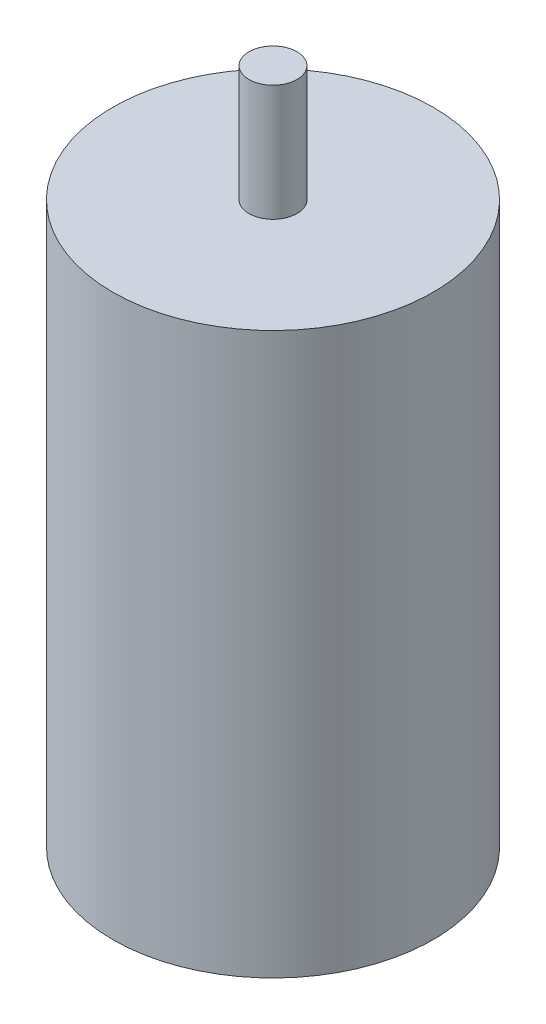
SolidWorks part; units mm, degrees
ref_plane "Front Plane" through (0, 0, 0) normal (0, 0, 1) x (1, 0, 0)
ref_plane "Top Plane" through (0, 0, 0) normal (0, 1, 0) x (1, 0, 0)
ref_plane "Right Plane" through (0, 0, 0) normal (1, 0, 0) x (0, 0, -1)
sketch "Sketch1" plane through (0, 0, 0) normal (0, 1, 0) x (1, 0, 0)
  circle A0 centre (0, 0) radius 20
  dimension "D1" = 40
extrude "Extrude1" add sketch "Sketch1" along normal blind 70
sketch "Sketch4" plane through (0, 70, 0) normal (0, 1, 0) x (-1, 0, 0)
  circle A0 centre (0, 0) radius 3
  dimension "D1" = 6
extrude "Extrude2" add sketch "Sketch4" along normal blind 14.5
